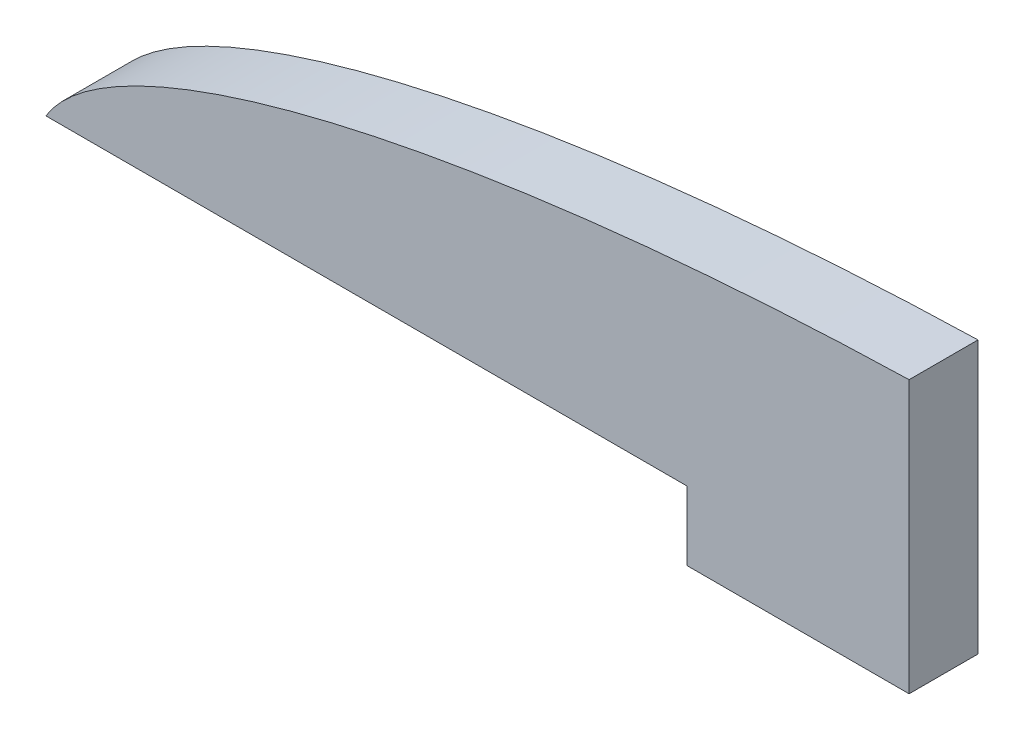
SolidWorks part; units mm, degrees
ref_plane "Front Plane" through (0, 0, 0) normal (0, 0, 1) x (1, 0, 0)
ref_plane "Top Plane" through (0, 0, 0) normal (0, 1, 0) x (1, 0, 0)
ref_plane "Right Plane" through (0, 0, 0) normal (1, 0, 0) x (0, 0, -1)
sketch "Sketch1" plane through (0, 0, 0) normal (0, 0, 1) x (1, 0, 0)
  line L0 (0, 0) -> (-4.7625, 0) construction
  line L1 (-4.7625, 0) -> (-4.7625, 10.9471)
  line L2 (-4.7625, 0) -> (-4.7625, -1.5875)
  line L3 (-4.7625, -1.5875) -> (-15, -1.5875)
  line L4 (-15, -1.5875) -> (-15, 1.5875)
  line L5 (-15, 1.5875) -> (-44.5297, 1.5875)
  ellipse E0 centre (0, 0) end of major axis (-45, 0) minor radius 20 construction
  ellipse E1 centre (0, 0) end of major axis (-45, 0) minor radius 11.0089 (-4.7625, 10.9471) -> (-44.5297, 1.5875) ccw
  point P6 (0, 0)
  point P9 (0, 0)
  point P14 (-4.7625, 14.5641)
  point P15 (-4.7625, 11.0089)
  dimension "D1" = 3.175
  dimension "D2" = 10.2375
  dimension "D3" = 1.5875
  dimension "D4" = 4.7625
extrude "Boss-Extrude1" add sketch "Sketch1" along normal blind 3.175
